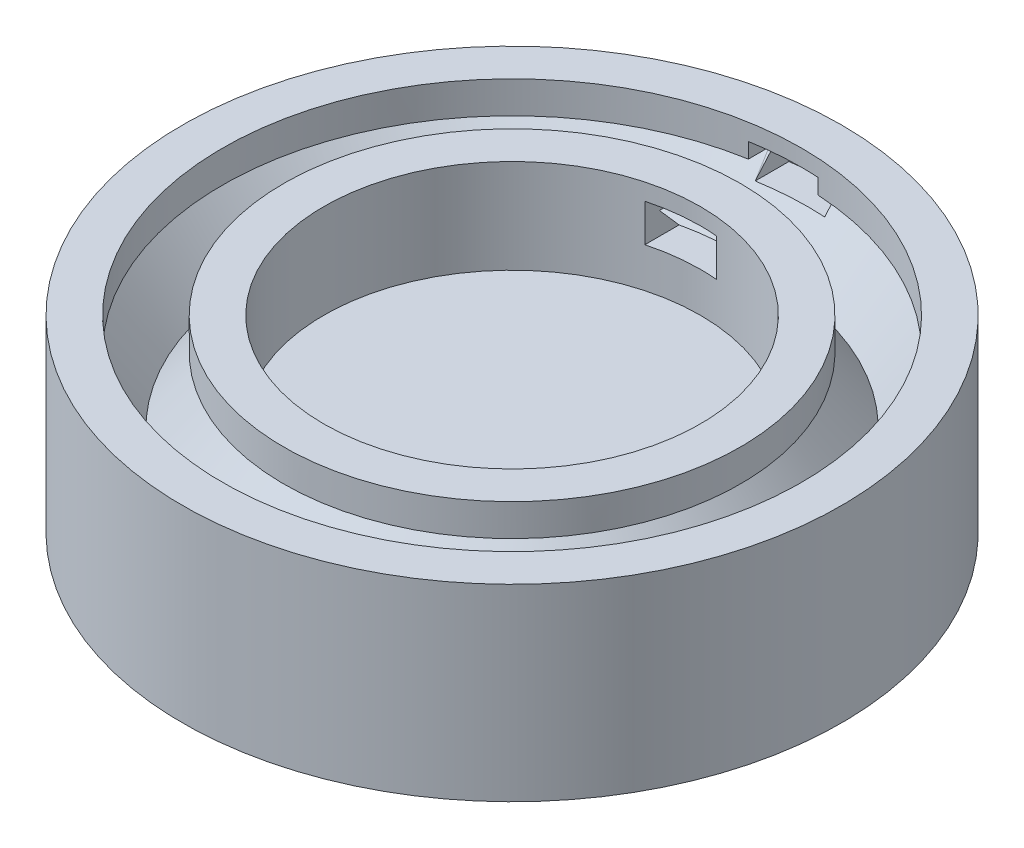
SolidWorks part; units mm, degrees
ref_plane "Front Plane" through (0, 0, 0) normal (0, 0, 1) x (1, 0, 0)
ref_plane "Top Plane" through (0, 0, 0) normal (0, 1, 0) x (1, 0, 0)
ref_plane "Right Plane" through (0, 0, 0) normal (1, 0, 0) x (0, 0, -1)
sketch "Sketch1" plane through (0, 0, 0) normal (0, 0, 1) x (1, 0, 0)
  line L0 (0, 0) -> (0, 15) construction
  line L1 (0, 0) -> (35, 0)
  line L2 (35, 0) -> (35, 20)
  line L4 (0, 10) -> (20, 10)
  line L5 (20, 10) -> (20, 20)
  line L6 (20, 20) -> (24.25, 20)
  line L7 (0, 0) -> (0, 10)
  line L8 (24.25, 20) -> (24.25, 16.6)
  line L9 (24.25, 16.6) -> (21.5, 16.6)
  line L10 (21.5, 16.6) -> (27.5, 9.6)
  line L11 (27.5, 9.6) -> (33.5, 16.6)
  line L12 (33.5, 16.6) -> (30.75, 16.6)
  line L13 (30.75, 16.6) -> (30.75, 20)
  line L14 (30.75, 20) -> (35, 20)
  dimension "D1" = 35
  dimension "D2" = 20
  dimension "D3" = 20
  dimension "D4" = 10
  dimension "D5" = 27.5
  dimension "D6" = 6.5
  dimension "D7" = 3.4
  dimension "D8" = 7
  dimension "D9" = 12
revolve "Revolve1" add sketch "Sketch1" angle 360 about L0
sketch "Sketch2" plane through (0, 0, 0) normal (0, 0, 1) x (1, 0, 0)
  line L1 (-5.2096, 18.2251) -> (1.7904, 18.2251)
  line L2 (-5.2096, 18.2251) -> (-5.2096, 14.2251)
  line L3 (-5.2096, 14.2251) -> (1.7904, 14.2251)
  line L4 (1.7904, 18.2251) -> (1.7904, 14.2251)
  line L5 (-5.2096, 18.2251) -> (1.7904, 14.2251) construction
  line L6 (-5.2096, 14.2251) -> (1.7904, 18.2251) construction
  point P0 (-1.7096, 16.2251)
  point P5 (-0.5331, 18.7667)
  point P6 (-1.7096, 16.2251)
  dimension "D1" = 7
  dimension "D2" = 4
extrude "Cut-Extrude3" cut sketch "Sketch2" along normal blind 15 and the other way blind 15 from offset 30
